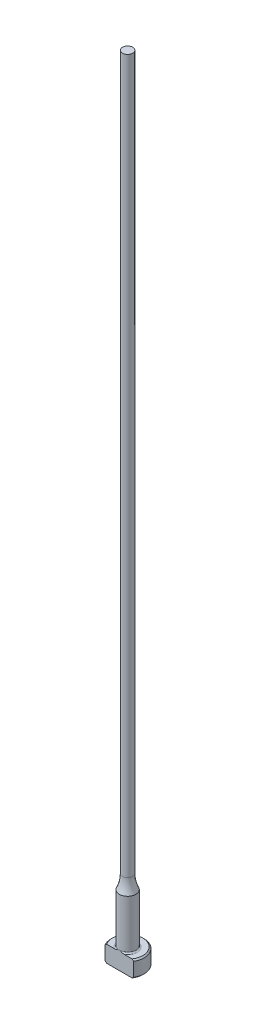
SolidWorks part; units mm, degrees
ref_plane "Front Plane" through (0, 0, 0) normal (0, 0, 1) x (1, 0, 0)
ref_plane "Top Plane" through (0, 0, 0) normal (0, 1, 0) x (1, 0, 0)
ref_plane "Right Plane" through (0, 0, 0) normal (1, 0, 0) x (0, 0, -1)
sketch "Sketch1" plane through (0, 0, 0) normal (0, 0, 1) x (1, 0, 0)
  line L0 (0, 259.9588) -> (0, -15.1925) construction
  line L1 (0, 0) -> (-3.175, 0)
  line L2 (-3.175, 0) -> (-3.175, 3.175)
  line L3 (-3.175, 3.175) -> (-1.5875, 3.175)
  line L4 (-0.9919, 15.3851) -> (-0.9919, 152.4)
  line L5 (-0.9919, 152.4) -> (0, 152.4)
  line L6 (0, 152.4) -> (0, 0)
  line L7 (-1.5875, 3.175) -> (-1.5875, 12.7)
  arc A0 (-1.5875, 12.7) -> (-0.9919, 15.3851) centre (-7.3419, 15.3851) ccw
  point P13 (-1.5875, 0)
  dimension "D1" = 6.35
  dimension "L" = 152.4
  dimension "D2" = 3.175
  dimension "H" = 6.35
  dimension "T" = 3.175
  dimension "D" = 1.9837
  dimension "S" = 12.7
revolve "Revolve1" add sketch "Sketch1" angle 360 about L0
chamfer "Chamfer1" distance 0.254 angle 45 2 edges at (0, 3.175, 3.175) (0, 0, 3.175)
fillet "Fillet1" radius 0.254 1 edges at (0, 3.175, 1.5875)
sketch "Sketch2" plane through (0, 0, 0) normal (0, -1, 0) x (1, 0, 0)
  line L0 (-2.7496, 1.5875) -> (2.7496, 1.5875)
  arc A0 (2.7496, 1.5875) -> (-2.7496, 1.5875) centre (0, 0) ccw
  circle A1 centre (0, 0) radius 3.175 construction
  circle A2 centre (0, 0) radius 1.5875 construction
extrude "Cut-Extrude1" cut sketch "Sketch2" against normal through all
